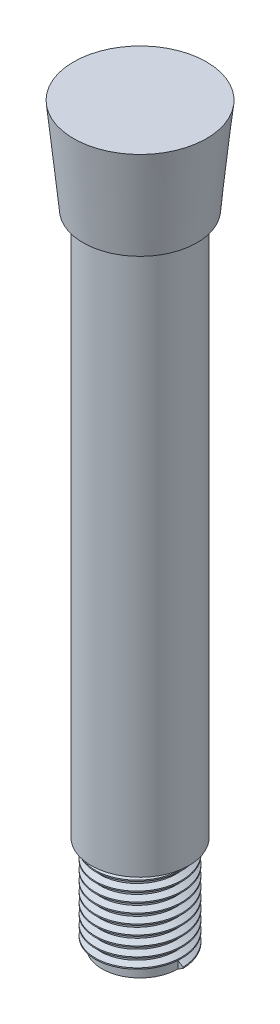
SolidWorks part; units mm, degrees
ref_plane "前视基准面" through (0, 0, 0) normal (0, 0, 1) x (1, 0, 0)
ref_plane "上视基准面" through (0, 0, 0) normal (0, 1, 0) x (1, 0, 0)
ref_plane "右视基准面" through (0, 0, 0) normal (1, 0, 0) x (0, 0, -1)
sketch "草图1" plane through (0, 0, 0) normal (0, 0, 1) x (1, 0, 0)
  line L0 (0, 0) -> (0, 77.23) construction
  line L1 (0, 0) -> (5.1487, 0)
  line L2 (5.1487, 0) -> (5.1487, 67.23)
  line L3 (0, 77.23) -> (7, 77.23)
  line L4 (7, 77.23) -> (6, 67.23)
  line L5 (6, 67.23) -> (5.1487, 67.23)
  line L6 (0, 0) -> (0, 77.23)
  dimension "D1" = 10
  dimension "D2" = 7
  dimension "D3" = 6
revolve "旋转1" add sketch "草图1" angle 360 about L6
sketch "草图2" plane through (0, 0, 0) normal (0, -1, 0) x (1, 0, 0)
  circle A0 centre (0, 0) radius 4
extrude "切除-拉伸1" cut sketch "草图2" against normal blind 10 flip side to cut
thread "螺纹线1" pitch 1 start angle 0, offset 0, length 10, pitch 1, diameter 8
ref_plane "基准面1" through (4, 0, 0) normal (0, 0, 1) x (1, 0, 0)
sketch "螺纹线轮廓1" plane through (4, 0, 0) normal (0, 0, 1) x (1, 0, 0)
  line L0 (0, 0) -> (0, 1) construction
  line L1 (0, 0) -> (0.5413, 0.3125)
  line L2 (0.5413, 0.3125) -> (0.5413, 0.4375)
  line L3 (0.5413, 0.4375) -> (0, 0.75)
  line L4 (0.5413, 0.375) -> (0, 0.375) construction
  line L11 (0, 0) -> (0, 0.75)
  point P2 (0, 0)
  dimension "Pitch" = 1
  dimension "Profile_Angle" = 60
  dimension "Profile_Land" = 0.125
  dimension "Profile_Height" = 0.5413
